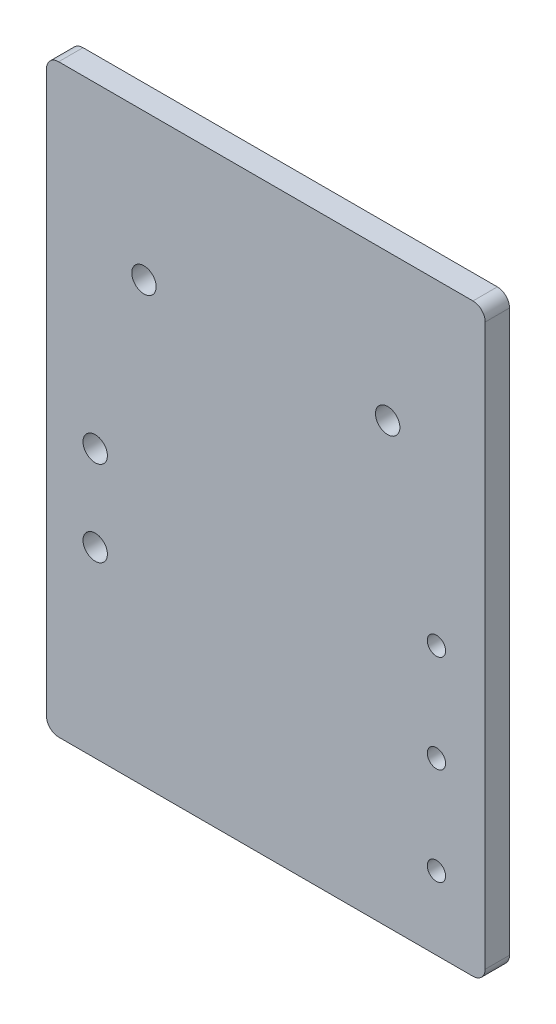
SolidWorks part; units mm, degrees
ref_plane "Front Plane" through (0, 0, 0) normal (0, 0, 1) x (1, 0, 0)
ref_plane "Top Plane" through (0, 0, 0) normal (0, 1, 0) x (1, 0, 0)
ref_plane "Right Plane" through (0, 0, 0) normal (1, 0, 0) x (0, 0, -1)
sketch "Sketch1" plane through (0, 0, 0) normal (0, 0, 1) x (1, 0, 0)
  line L0 (0, 0) -> (57.15, 0)
  line L1 (57.15, 0) -> (57.15, 152.4)
  line L2 (57.15, 152.4) -> (-57.15, 152.4)
  line L3 (-57.15, 152.4) -> (-57.15, 0)
  line L4 (-57.15, 0) -> (0, 0)
  line L5 (0, 0) -> (0, 22.7932) construction
  circle A0 centre (-31.75, 114.3) radius 3.175
  circle A1 centre (31.75, 114.3) radius 3.175
  circle A2 centre (-44.45, 47.625) radius 3.175
  circle A3 centre (-44.45, 69.85) radius 3.175
  circle A4 centre (44.45, 19.05) radius 2.3876
  circle A5 centre (44.45, 44.45) radius 2.3876
  circle A6 centre (44.45, 69.85) radius 2.3876
  dimension "D5" = 6.35
  dimension "D9" = 4.7752
  dimension "D1" = 114.3
  dimension "D2" = 152.4
  dimension "D3" = 63.5
  dimension "D4" = 38.1
  dimension "D6" = 22.225
  dimension "D7" = 47.625
  dimension "D8" = 12.7
  dimension "D10" = 25.4
  dimension "D11" = 25.4
  dimension "D12" = 12.7
  dimension "D13" = 44.45
extrude "Boss-Extrude1" add sketch "Sketch1" along normal blind 6.35
fillet "Fillet1" radius 3.175 4 edges at (-57.15, 0, 3.175) (57.15, 0, 3.175) (-57.15, 152.4, 3.175) (57.15, 152.4, 3.175)
